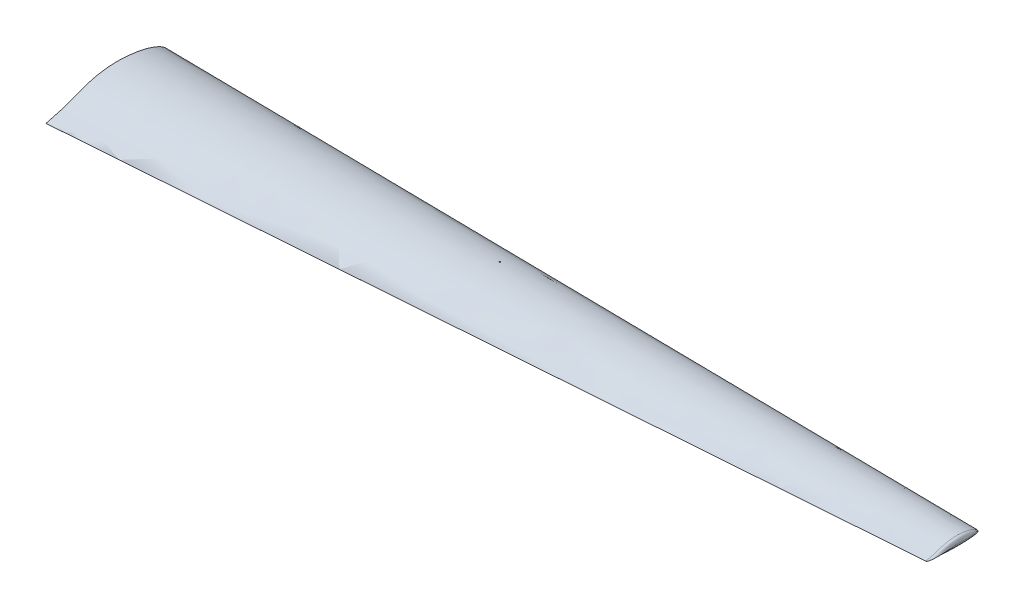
SolidWorks part; units mm, degrees
other "<Aile gauche>-<Enlèv. mat.-Extru.1>"
ref_plane "Front Plane" through (0, 0, 0) normal (0, 0, 1) x (1, 0, 0)
ref_plane "Top Plane" through (0, 0, 0) normal (0, 1, 0) x (1, 0, 0)
ref_plane "Right Plane" through (0, 0, 0) normal (1, 0, 0) x (0, 0, -1)
mirrored part "Aile gauche_Symétrique"
